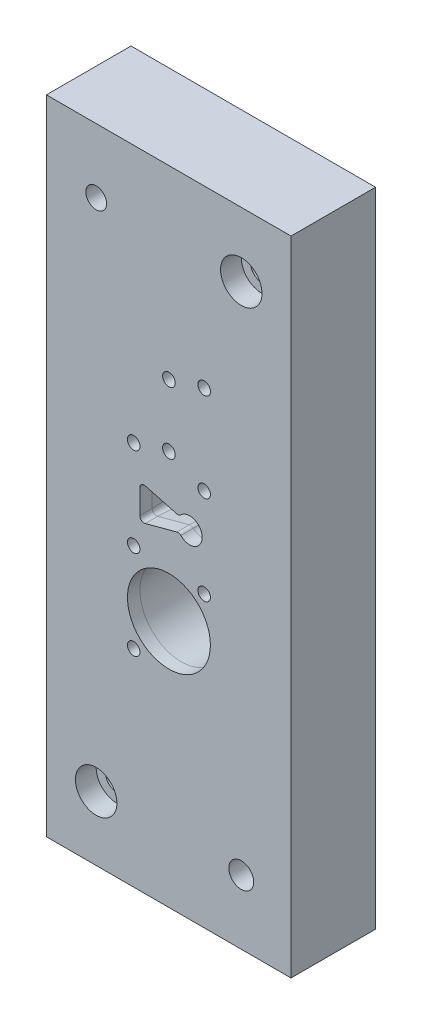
SolidWorks part; units mm, degrees
ref_plane "Plan de face" through (0, 0, 0) normal (0, 0, 1) x (1, 0, 0)
ref_plane "Plan de dessus" through (0, 0, 0) normal (0, 1, 0) x (1, 0, 0)
ref_plane "Plan de droite" through (0, 0, 0) normal (1, 0, 0) x (0, 0, -1)
sketch "Esquisse1" plane through (0, 0, 0) normal (0, 0, 1) x (1, 0, 0)
  line L1 (29.5, 77.5) -> (-29.5, 77.5)
  line L3 (-29.5, -77.5) -> (29.5, -77.5)
  line L4 (0, -128.0019) -> (0, 188.3465) construction
  line L5 (30, -78) -> (30, 78) construction
  line L6 (-30, 78) -> (-30, -78) construction
  line L7 (29.5, -77.5) -> (29.5, 77.5)
  line L8 (-29.5, -77.5) -> (-29.5, 77.5)
  line L9 (-30, -78) -> (-11, -78) construction
  line L10 (-11, 78) -> (-30, 78) construction
  circle A0 centre (-17.5, 62) radius 2.5035 construction
  circle A1 centre (-17.5, 62) radius 2.5035
  circle A2 centre (17.5, -62) radius 3.0035 construction
  circle A3 centre (17.5, -62) radius 3.0035
  dimension "D1" = 59
  dimension "D2" = 0.5
  dimension "D3" = 0.5
extrude "Extrusion1" add sketch "Esquisse1" along normal blind 20.4
hole_wizard "Chambrage pour vis à tête cylindrique à 6 pans creux (ou vis CHC) M51" positions "Esquisse3" profile "Esquisse2" counterbore size "M5" standard "Ansi Métrique"
sketch "Esquisse3" plane through (0, 0, 20.4) normal (0, 0, 1) x (1, 0, 0)
  point P0 (17.5, 62)
  point P1 (-17.5, -62)
sketch "Esquisse2" plane through (17.5, 62, 20.4) normal (1, 0, 0) x (0, -1, 0)
  line L0 (0, 0) -> (0, 20.4)
  line L1 (0, 20.4) -> (2.75, 20.4)
  line L3 (2.75, 20.4) -> (2.75, 5)
  line L4 (2.75, 5) -> (5, 5)
  line L5 (5, 5) -> (5, 0)
  line L7 (5, 0) -> (0, 0)
  line L11 (0, -6.35) -> (0, 107.95) construction
  dimension "Diamètre du perçage jusqu'au prochain" = 5.5
  dimension "Profondeur du perçage jusqu'au prochain" = 20.4
  dimension "Diamètre du chambrage" = 10
  dimension "Profondeur du chambrage" = 5
ref_plane "Plan1" through (0, 0, 17.4) normal (0, 0, 1) x (1, 0, 0)
sketch "Esquisse4" plane through (0, 0, 20.4) normal (0, 0, 1) x (1, 0, 0)
  line L6 (1.9705, 5.6915) -> (-5.6834, 7.7423)
  line L7 (-6.98, 6.7474) -> (-6.98, 0.8526)
  line L8 (-5.6834, -0.1423) -> (1.9705, 1.9085)
  line L9 (1.9705, 5.6915) -> (-5.6834, 7.7423)
  line L10 (-6.98, 6.7474) -> (-6.98, 0.8526)
  line L11 (-5.6834, -0.1423) -> (1.9705, 1.9085)
  circle A0 centre (0.05, -17.7) radius 10 construction
  circle A1 centre (0.05, -17.7) radius 10
  circle A7 centre (8.55, 35.2679) radius 1.5285
  circle A8 centre (0.05, 32.8) radius 1.5285
  circle A9 centre (0.05, 17.8) radius 1.5285
  circle A10 centre (-8.45, 15.3321) radius 1.5285
  arc A12 (1.9705, 5.6915) -> (2.9075, 5.9425) centre (2.2216, 6.6284) ccw
  arc A13 (-5.6834, 7.7423) -> (-6.98, 6.7474) centre (-5.95, 6.7474) ccw
  arc A14 (-6.98, 0.8526) -> (-5.6834, -0.1423) centre (-5.95, 0.8526) ccw
  arc A15 (2.9075, 1.6575) -> (1.9705, 1.9085) centre (2.2216, 0.9716) ccw
  arc A16 (2.9075, 1.6575) -> (2.9075, 5.9425) centre (5.05, 3.8) ccw
  arc A17 (1.9705, 5.6915) -> (2.9075, 5.9425) centre (2.2216, 6.6284) ccw
  arc A18 (-5.6834, 7.7423) -> (-6.98, 6.7474) centre (-5.95, 6.7474) ccw
  arc A19 (-6.98, 0.8526) -> (-5.6834, -0.1423) centre (-5.95, 0.8526) ccw
  arc A20 (2.9075, 1.6575) -> (1.9705, 1.9085) centre (2.2216, 0.9716) ccw
  arc A21 (2.9075, 1.6575) -> (2.9075, 5.9425) centre (5.05, 3.8) ccw
  circle A26 centre (8.55, 13.7679) radius 1.5035
  circle A27 centre (-8.45, -6.1679) radius 1.5035
  circle A28 centre (8.55, -7.7321) radius 1.5035
  circle A29 centre (-8.45, -27.6679) radius 1.5035
  dimension "D2" = 3.057
  dimension "D3" = 3.007
  dimension "D1" = 0.03
extrude "Enlèv. mat.-Extru.1" cut sketch "Esquisse4" against normal blind 3
sketch "Esquisse5" plane through (0, 0, 17.4) normal (0, 0, 1) x (1, 0, 0)
  line L0 (1.9705, 5.6915) -> (-5.6834, 7.7423) construction
  line L1 (-6.98, 6.7474) -> (-6.98, 0.8526) construction
  line L2 (-5.6834, -0.1423) -> (1.9705, 1.9085) construction
  line L3 (1.9705, 5.6915) -> (-5.6834, 7.7423)
  line L4 (-6.98, 6.7474) -> (-6.98, 0.8526)
  line L5 (-5.6834, -0.1423) -> (1.9705, 1.9085)
  circle A0 centre (0.05, -17.7) radius 10 construction
  arc A1 (1.9705, 5.6915) -> (2.9075, 5.9425) centre (2.2216, 6.6284) ccw construction
  arc A2 (-5.6834, 7.7423) -> (-6.98, 6.7474) centre (-5.95, 6.7474) ccw construction
  arc A3 (-6.98, 0.8526) -> (-5.6834, -0.1423) centre (-5.95, 0.8526) ccw construction
  arc A4 (2.9075, 1.6575) -> (1.9705, 1.9085) centre (2.2216, 0.9716) ccw construction
  arc A5 (2.9075, 1.6575) -> (2.9075, 5.9425) centre (5.05, 3.8) ccw construction
  circle A10 centre (0.05, 17.8) radius 1.5285 construction
  circle A11 centre (-8.45, 15.3321) radius 1.5285 construction
  circle A12 centre (0.05, 32.8) radius 1.5285 construction
  circle A13 centre (8.55, 35.2679) radius 1.5285 construction
  circle A14 centre (0.05, -17.7) radius 10
  arc A15 (1.9705, 5.6915) -> (2.9075, 5.9425) centre (2.2216, 6.6284) ccw
  arc A16 (-5.6834, 7.7423) -> (-6.98, 6.7474) centre (-5.95, 6.7474) ccw
  arc A17 (-6.98, 0.8526) -> (-5.6834, -0.1423) centre (-5.95, 0.8526) ccw
  arc A18 (2.9075, 1.6575) -> (1.9705, 1.9085) centre (2.2216, 0.9716) ccw
  arc A19 (2.9075, 1.6575) -> (2.9075, 5.9425) centre (5.05, 3.8) ccw
  circle A24 centre (0.05, 17.8) radius 1.5285
  circle A25 centre (-8.45, 15.3321) radius 1.5285
  circle A26 centre (0.05, 32.8) radius 1.5285
  circle A27 centre (8.55, 35.2679) radius 1.5285
extrude "Enlèv. mat.-Extru.2" cut sketch "Esquisse5" against normal through all draft 3
sketch "Esquisse6" plane through (0, 0, 17.4) normal (0, 0, 1) x (1, 0, 0)
  circle A0 centre (8.55, 13.7679) radius 1.5035 construction
  circle A1 centre (-8.45, -6.1679) radius 1.5035 construction
  circle A2 centre (8.55, -7.7321) radius 1.5035 construction
  circle A3 centre (-8.45, -27.6679) radius 1.5035 construction
  circle A4 centre (8.55, 13.7679) radius 1.5035
  circle A5 centre (-8.45, -6.1679) radius 1.5035
  circle A6 centre (8.55, -7.7321) radius 1.5035
  circle A7 centre (-8.45, -27.6679) radius 1.5035
extrude "Enlèv. mat.-Extru.3" cut sketch "Esquisse6" against normal through all
